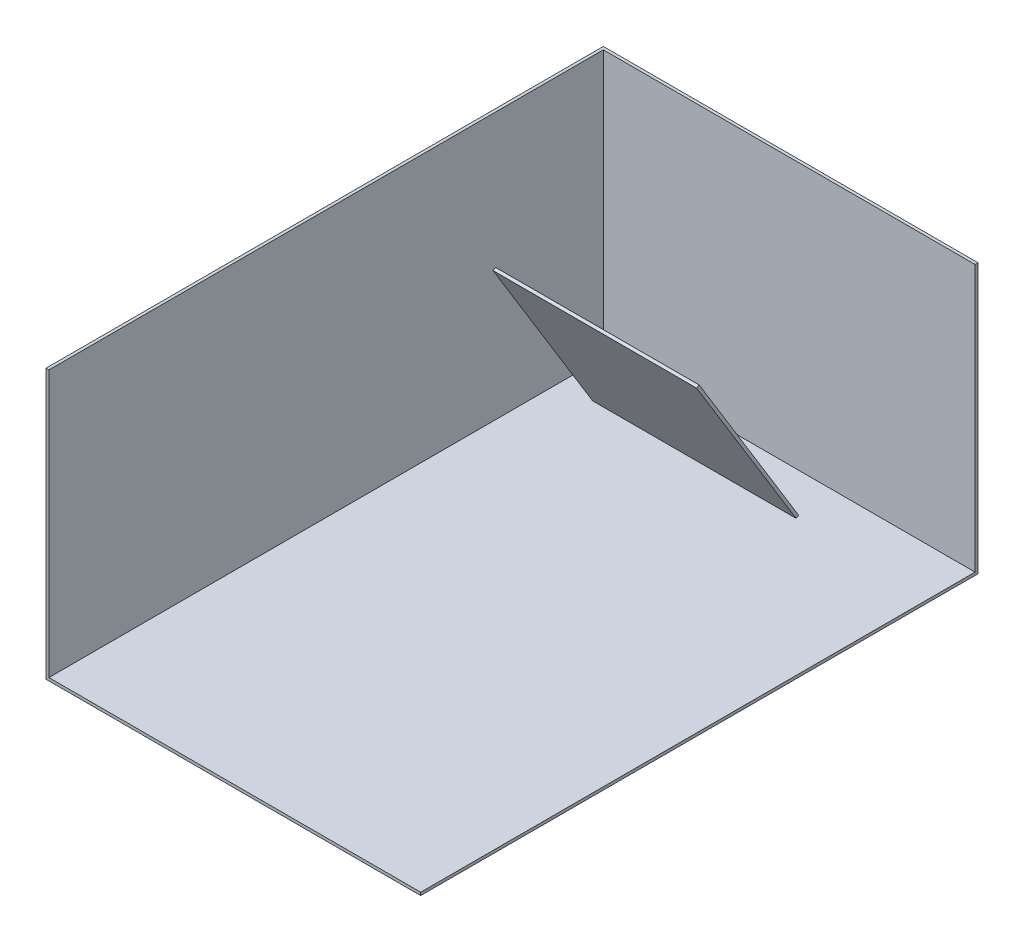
SolidWorks part; units mm, degrees
ref_plane "Ebene vorne" through (0, 0, 0) normal (0, 0, 1) x (1, 0, 0)
ref_plane "Ebene oben" through (0, 0, 0) normal (0, 1, 0) x (1, 0, 0)
ref_plane "Ebene rechts" through (0, 0, 0) normal (1, 0, 0) x (0, 0, -1)
sketch "Skizze1" plane through (0, 0, 0) normal (0, 0, 1) x (1, 0, 0)
  line L1 (0, 0) -> (128.8774, 0)
  line L2 (0, 0) -> (0, 92.6548)
  line L3 (0, 92.6548) -> (128.8774, 92.6548)
  line L4 (128.8774, 0) -> (128.8774, 92.6548)
extrude "Linear austragen1" add sketch "Skizze1" along normal blind 191.7
shell "Wandung1" thickness 1
sketch "Skizze2" plane through (0, 0, 0) normal (1, 0, 0) x (0, 0, -1)
  line L0 (-57.0536, 65.3452) -> (-22.8214, 9.4327)
extrude "Linear-Austragen-Dünn1" add sketch "Skizze2" along normal blind 70 separate body thin
move or copy body "Körper-Verschieben/Kopieren1" bodies to move or copy 102
